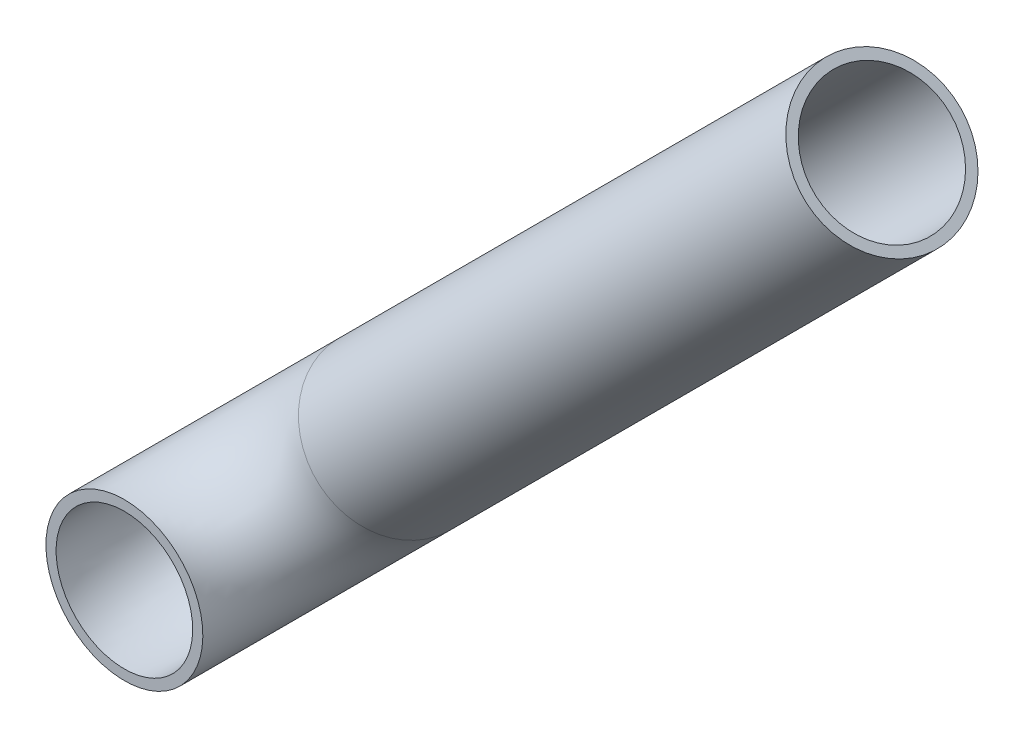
SolidWorks part; units mm, degrees
ref_plane "Front" through (0, 0, 0) normal (0, 0, 1) x (1, 0, 0)
ref_plane "Top" through (0, 0, 0) normal (0, 1, 0) x (1, 0, 0)
ref_plane "Side" through (0, 0, 0) normal (1, 0, 0) x (0, 0, -1)
sketch "PipeSketch"
  dimension "OuterDiameter" = 60.452
  dimension "InnerDiameter" = 52.6288
sketch "FilterSketch" plane through (0, 0, 0) normal (0, 0, 1) x (1, 0, 0)
  circle A0 centre (0, 0) radius 25.4 construction
  dimension "NominalDiameter" = 50.8
sketch3d "3DSketch1"
  line L0 (43.1052, 43.1052, -60.96) -> (230.8577, 230.8577, -60.96) construction
  line L1 (43.1052, 43.1052, -60.96) -> (230.8577, 230.8577, -60.96)
  arc A0 (0, 0, 0) -> (43.1052, 43.1052, -60.96) centre (43.1052, 43.1052, 0) ccw construction
  arc A1 (0, 0, 0) -> (43.1052, 43.1052, -60.96) centre (43.1052, 43.1052, 0) ccw
  point P3 (86.2105, 0, 0)
  point P4 (86.2105, 0, 0)
sweep "Sweep1" add profiles "PipeSketch" path "3DSketch1"
sketch "Sketch1" plane through (0, 0, -60.96) normal (0, 0, 1) x (1, 0, 0)
  circle A0 centre (106.9111, 106.9111) radius 10.4648 construction
  circle A1 centre (106.9111, 106.9111) radius 10.4648
extrude "Cut-Extrude1" cut sketch "Sketch1" against normal up to surface
